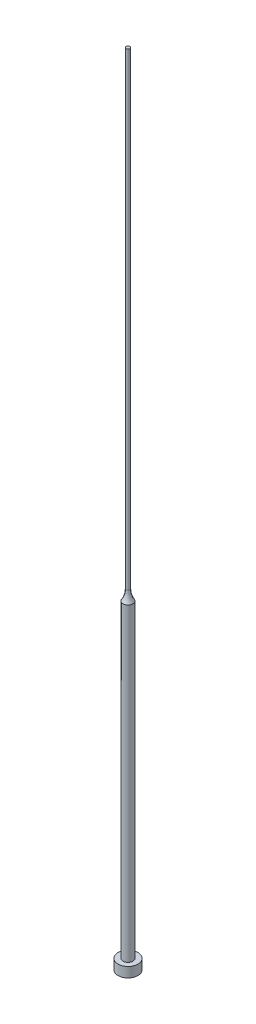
SolidWorks part; units mm, degrees
ref_plane "Front Plane" through (0, 0, 0) normal (0, 0, 1) x (1, 0, 0)
ref_plane "Top Plane" through (0, 0, 0) normal (0, 1, 0) x (1, 0, 0)
ref_plane "Right Plane" through (0, 0, 0) normal (1, 0, 0) x (0, 0, -1)
sketch "Sketch2" plane through (0, 0, 0) normal (0, 0, 1) x (1, 0, 0)
  line L0 (0, 0) -> (3.175, 0)
  line L1 (55, 0) -> (-55, 0) construction
  line L2 (3.175, 0) -> (3.175, 3.175)
  line L3 (3.175, 3.175) -> (1.5875, 3.175)
  line L4 (1.5875, 3.175) -> (1.5875, 101.6)
  line L5 (1.5875, 101.6) -> (0.5944, 101.6)
  line L6 (0.5944, 101.6) -> (0.5944, 254)
  line L7 (0.5944, 254) -> (0, 254)
  line L8 (0, 254) -> (0, 0)
  dimension "D1" = 3.175
  dimension "D2" = 3.175
  dimension "D3" = 1.5875
  dimension "D4" = 101.6
  dimension "D5" = 0.5944
  dimension "D6" = 254
revolve "Revolve1" add sketch "Sketch2" angle 360 about L8
fillet "Fillet1" radius 6.35 1 edges at (-0.5944, 101.6, 0)
